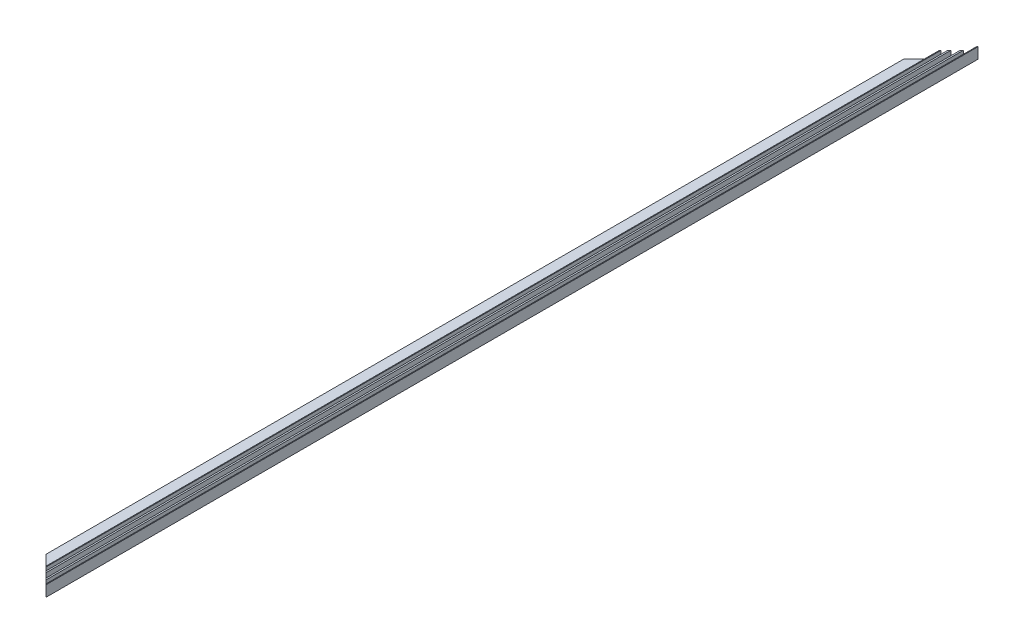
SolidWorks part; units mm, degrees
ref_plane "Ön Düzlem" through (0, 0, 0) normal (0, 0, 1) x (1, 0, 0)
ref_plane "Üst Düzlem" through (0, 0, 0) normal (0, 1, 0) x (1, 0, 0)
ref_plane "Sağ Düzlem" through (0, 0, 0) normal (1, 0, 0) x (0, 0, -1)
sketch "Çizim2" plane through (0, 0, 0) normal (0, 0, 1) x (1, 0, 0)
  line L0 (-63.1554, 0) -> (-51.1554, 0)
  line L1 (-51.1554, 0) -> (-51.1554, 0.5)
  line L2 (-51.5554, 0.5058) -> (-63.1554, 0.5058)
  line L3 (-63.1554, 0.5058) -> (-63.1554, 0)
  line L4 (-51.1554, 0.5) -> (-39.1554, 0.5)
  line L5 (-39.1554, 0.5) -> (-39.1554, 7.5)
  line L6 (-39.1554, 7.5) -> (-39.6554, 7.5)
  line L7 (-39.6554, 7.5) -> (-39.6554, 5.5)
  line L8 (-39.6554, 5.5) -> (-40.6554, 5.5)
  line L9 (-40.6554, 5.5) -> (-40.6554, 1)
  line L10 (-40.6554, 1) -> (-43.8554, 1)
  line L11 (-43.8554, 1) -> (-43.8554, 5.5)
  line L12 (-43.8554, 5.5) -> (-44.8554, 5.5)
  line L13 (-44.8554, 5.5) -> (-44.8554, 1)
  line L14 (-44.8554, 1) -> (-47.8554, 1)
  line L15 (-47.8554, 1) -> (-47.8554, 5.5)
  line L16 (-47.8554, 5.5) -> (-48.8554, 5.5)
  line L17 (-48.8554, 5.5) -> (-48.8554, 1)
  line L18 (-48.8554, 1) -> (-51.0554, 1)
  line L19 (-51.0554, 1) -> (-51.0554, 5.5)
  line L20 (-51.0554, 5.5) -> (-51.5554, 5.5)
  line L21 (-51.5554, 5.5) -> (-51.5554, 0.5058)
  dimension "D1" = 12
  dimension "D2" = 0.5
  dimension "D3" = 12
  dimension "D4" = 7
  dimension "D5" = 0.5
  dimension "D6" = 1
  dimension "D7" = 2
  dimension "D8" = 4.5
  dimension "D9" = 3.2
  dimension "D10" = 1
  dimension "D11" = 3
  dimension "D12" = 1
  dimension "D13" = 2.2
  dimension "D14" = 4.5
  dimension "D15" = 0.5
extrude "Yükseklik-Ekstrüzyon1" add sketch "Çizim2" along normal blind 600 contours L2 L3 L0 L1 L4 L5 L6 L7 L8 L9 L10 L11 L12 L13 L14 L15 L16 L17 L18 L19 L20 L21
sketch "Çizim3" plane through (0, 0, 0) normal (0, -1, 0) x (1, 0, 0)
  line L0 (-39.1554, 0) -> (-63.1554, 24)
  line L1 (-63.1554, 600) -> (-63.1554, 0) construction
  line L2 (-63.1554, 24) -> (-63.1554, 0)
  line L3 (-63.1554, 0) -> (-39.1554, 0)
  dimension "D1" = 45
extrude "Kes-Ekstrüzyon1" cut sketch "Çizim3" against normal blind 600
sketch "Çizim5" plane through (0, 0, 0) normal (0, -1, 0) x (1, 0, 0)
  line L0 (-39.1554, 600) -> (-63.1554, 576)
  line L1 (-63.1554, 600) -> (-63.1554, 24) construction
  line L2 (-63.1554, 576) -> (-63.1554, 600)
  line L3 (-63.1554, 600) -> (-39.1554, 600)
  dimension "D1" = 45
extrude "Kes-Ekstrüzyon2" cut sketch "Çizim5" against normal blind 600
